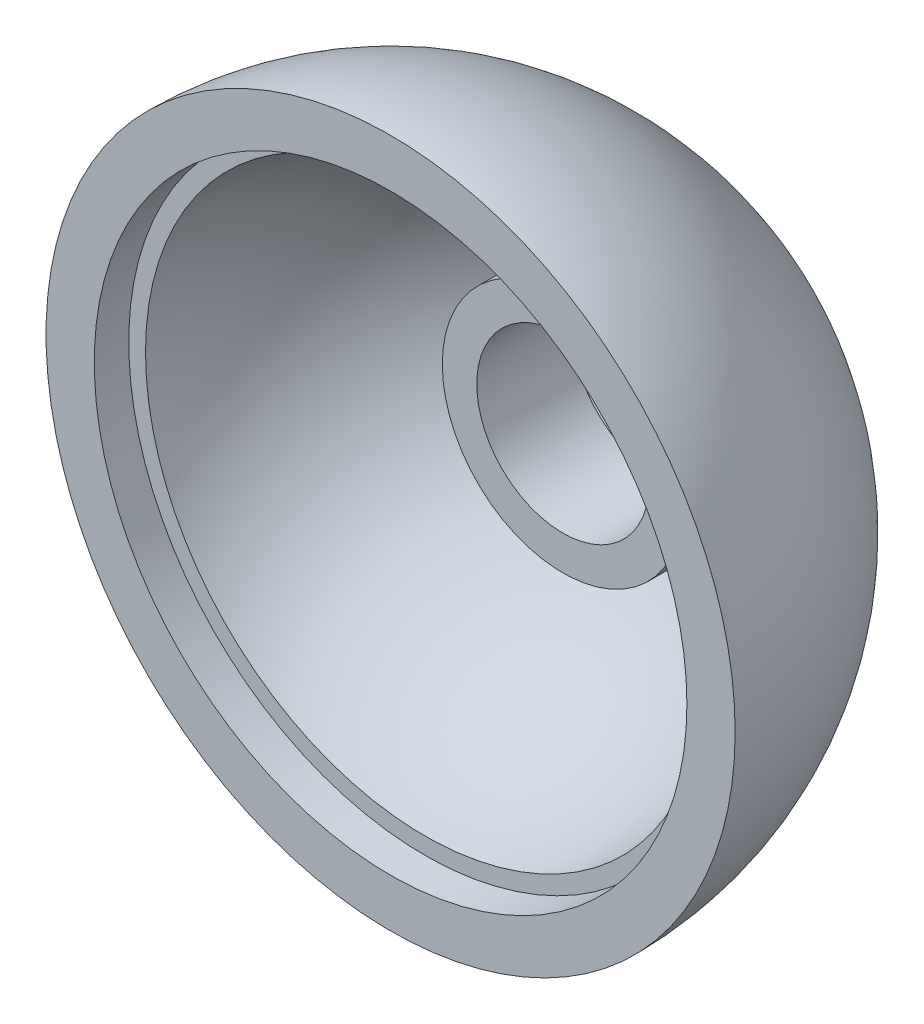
SolidWorks part; units mm, degrees
ref_plane "Plan de face" through (0, 0, 0) normal (0, 0, 1) x (1, 0, 0)
ref_plane "Plan de dessus" through (0, 0, 0) normal (0, 1, 0) x (1, 0, 0)
ref_plane "Plan de droite" through (0, 0, 0) normal (1, 0, 0) x (0, 0, -1)
sketch "Esquisse1" plane through (0, 0, 0) normal (0, 1, 0) x (1, 0, 0)
  line L0 (-10, 0) -> (-8.6, 0)
  line L1 (0, 0) -> (0, 10) construction
  line L2 (0, 0) -> (-10, 0) construction
  line L3 (-8.6, 0) -> (-8.6, 1)
  line L4 (-8.6, 1) -> (-8.1131, 1)
  line L5 (0, 10) -> (0, 8.1745)
  line L6 (-2.5, 7.7828) -> (-2.5, 5)
  line L7 (-2.5, 5) -> (-3.5, 5)
  line L8 (-3.5, 5) -> (-3.5, 7.3873)
  arc A0 (0, 10) -> (-10, 0) centre (0, 0) ccw
  arc A1 (0, 8.1745) -> (-2.5, 7.7828) centre (0, 0) ccw
  arc A2 (-3.5, 7.3873) -> (-8.1131, 1) centre (0, 0) ccw
  arc A3 (0, 8.1745) -> (-8.1745, 0) centre (0, 0) ccw construction
  dimension "D1" = 20
  dimension "D2" = 1
  dimension "D3" = 8.6
  dimension "D4" = 5
  dimension "D5" = 3.5
  dimension "D6" = 2.5
revolve "Révolution3" add sketch "Esquisse1" angle 360 about L1
